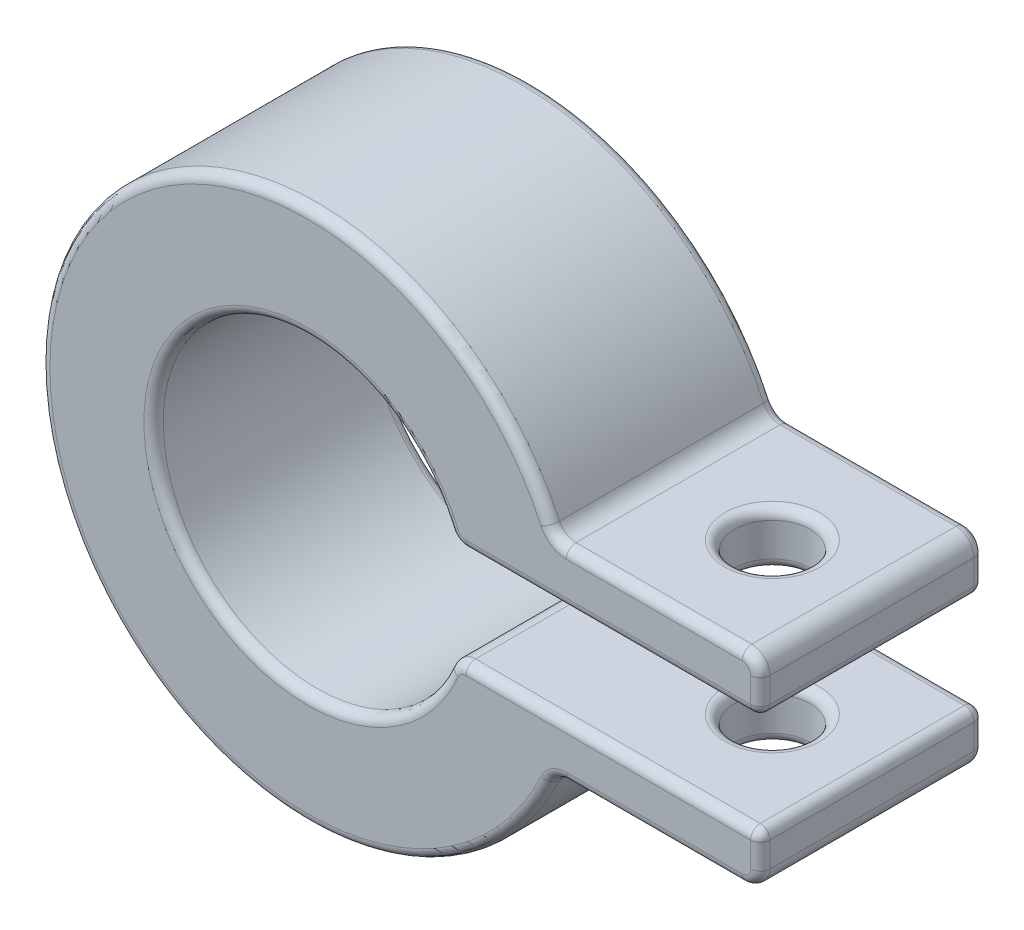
SolidWorks part; units mm, degrees
ref_plane "Front Plane" through (0, 0, 0) normal (0, 0, 1) x (1, 0, 0)
ref_plane "Top Plane" through (0, 0, 0) normal (0, 1, 0) x (1, 0, 0)
ref_plane "Right Plane" through (0, 0, 0) normal (1, 0, 0) x (0, 0, -1)
ref_plane "Plane1" through (0, 0, 181.102) normal (0, 0, 1) x (1, 0, 0)
sketch "Sketch3" plane through (0, 0, 181.102) normal (0, 0, 1) x (1, 0, 0)
  line L0 (0, 0) -> (74.4612, 0) construction
  line L1 (13.3294, -4.1275) -> (38.1, -4.1275)
  line L2 (13.3294, 4.1275) -> (38.1, 4.1275)
  line L3 (38.1, -4.1275) -> (38.1, -7.0485)
  line L4 (38.1, 4.1275) -> (38.1, 7.0485)
  line L5 (36.576, -8.5725) -> (21.7762, -8.5725)
  line L6 (36.576, 8.5725) -> (21.7762, 8.5725)
  arc A0 (38.1, -7.0485) -> (36.576, -8.5725) centre (36.576, -7.0485) cw
  arc A1 (21.7762, -8.5725) -> (20.3936, -9.4555) centre (21.7762, -10.0965) ccw
  arc A3 (11.9263, 5.0566) -> (11.9263, -5.0566) centre (0, 0) ccw
  arc A4 (38.1, 7.0485) -> (36.576, 8.5725) centre (36.576, 7.0485) ccw
  arc A6 (20.3936, 9.4555) -> (20.3936, -9.4555) centre (0, 0) ccw
  arc A7 (21.7762, 8.5725) -> (20.3936, 9.4555) centre (21.7762, 10.0965) cw
  arc A8 (13.3294, -4.1275) -> (11.9263, -5.0566) centre (13.3294, -5.6515) ccw
  arc A9 (13.3294, 4.1275) -> (11.9263, 5.0566) centre (13.3294, 5.6515) cw
  point P17 (38.1, -8.5725)
  point P20 (20.7802, -8.5725)
  point P23 (38.1, 8.5725)
  point P26 (20.7802, 8.5725)
  point P29 (12.2788, -4.1275)
  point P32 (12.2788, 4.1275)
  dimension "D6" = 1.524
  dimension "D1" = 22.479
  dimension "D2" = 12.954
  dimension "D3" = 4.445
  dimension "D4" = 8.255
  dimension "D5" = 38.1
extrude "Extrude1" add sketch "Sketch3" along normal mid plane 18.796
sketch "Sketch4" plane through (0, -8.5725, 0) normal (0, -1, 0) x (1, 0, 0)
  line L0 (38.1, 190.5) -> (38.1, 171.704) construction
  line L2 (21.7762, 171.704) -> (36.576, 171.704) construction
  circle A0 centre (29.845, 181.229) radius 3.175
  dimension "D1" = 6.35
  dimension "D2" = 8.255
  dimension "D3" = 9.525
extrude "Cut-Extrude1" cut sketch "Sketch4" against normal through all
fillet "Fillet1" radius 0.8128 34 edges at (25.7147, 4.1275, 171.704) (12.488, 4.3808, 171.704) (-12.954, 0, 171.704) (12.488, -4.3808, 171.704) (38.1, 5.588, 171.704) (37.6536, 8.1261, 171.704) (38.1, -5.588, 171.704) (37.6536, -8.1261, 171.704) (29.1761, -8.5725, 171.704) (20.956, -8.8121, 171.704) (-22.479, 0, 171.704) (20.956, 8.8121, 171.704) (25.7147, -4.1275, 190.5) (12.488, -4.3808, 190.5) (-12.954, 0, 190.5) (12.488, 4.3808, 190.5) (38.1, 5.588, 190.5) (37.6536, 8.1261, 190.5) (29.1761, 8.5725, 190.5) (20.956, 8.8121, 190.5) (38.1, -5.588, 190.5) (37.6536, -8.1261, 190.5) (29.1761, -8.5725, 190.5) (20.956, -8.8121, 190.5) (29.845, -4.1275, 178.054) (29.845, -8.5725, 178.054) (29.845, 4.1275, 184.404) (33.02, 8.5725, 181.229) (25.7147, -4.1275, 171.704) (29.1761, 8.5725, 171.704) (25.7147, 4.1275, 190.5) (-22.479, 0, 190.5) (38.1, -4.1275, 181.102) (38.1, 4.1275, 181.102)
